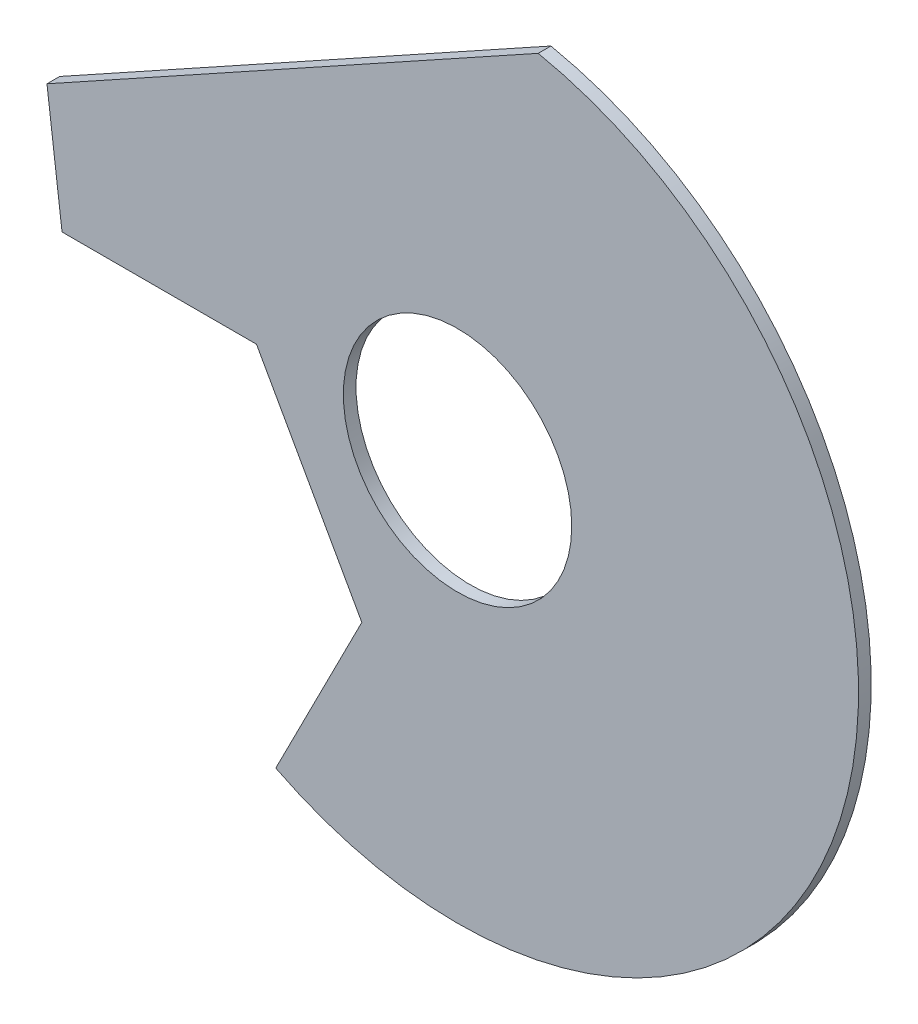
SolidWorks part; units mm, degrees
ref_plane "Plan de face" through (0, 0, 0) normal (0, 0, 1) x (1, 0, 0)
ref_plane "Plan de dessus" through (0, 0, 0) normal (0, 1, 0) x (1, 0, 0)
ref_plane "Plan de droite" through (0, 0, 0) normal (1, 0, 0) x (0, 0, -1)
sketch "Esquisse1" plane through (0, 0, 0) normal (0, 0, 1) x (1, 0, 0)
  line L0 (42.1788, 58.9769) -> (22.8231, 48.2595)
  line L1 (42.1788, 58.9769) -> (40, 57.7705) construction
  line L2 (22.8231, 48.2595) -> (23.4167, 43.5)
  line L3 (23.4167, 43.5) -> (31.0787, 43.5)
  line L4 (31.0787, 43.5) -> (35.2287, 36.084)
  line L5 (35.2287, 36.084) -> (31.838, 29.4165)
  arc A0 (31.838, 29.4165) -> (42.1788, 58.9769) centre (39, 43.5) ccw
  arc A1 (33.9657, 28.5235) -> (42.1788, 58.9769) centre (39, 43.5) ccw construction
extrude "Boss.-Extru.1" add sketch "Esquisse1" along normal blind 0.5
sketch "Esquisse2" plane through (0, 0, 0.5) normal (0, 0, 1) x (1, 0, 0)
  circle A0 centre (39, 43.5) radius 4.5
  arc A1 (31.838, 29.4165) -> (42.1788, 58.9769) centre (39, 43.5) ccw construction
  dimension "D1" = 9
extrude "Enlèv. mat.-Extru.1" cut sketch "Esquisse2" against normal blind 10
